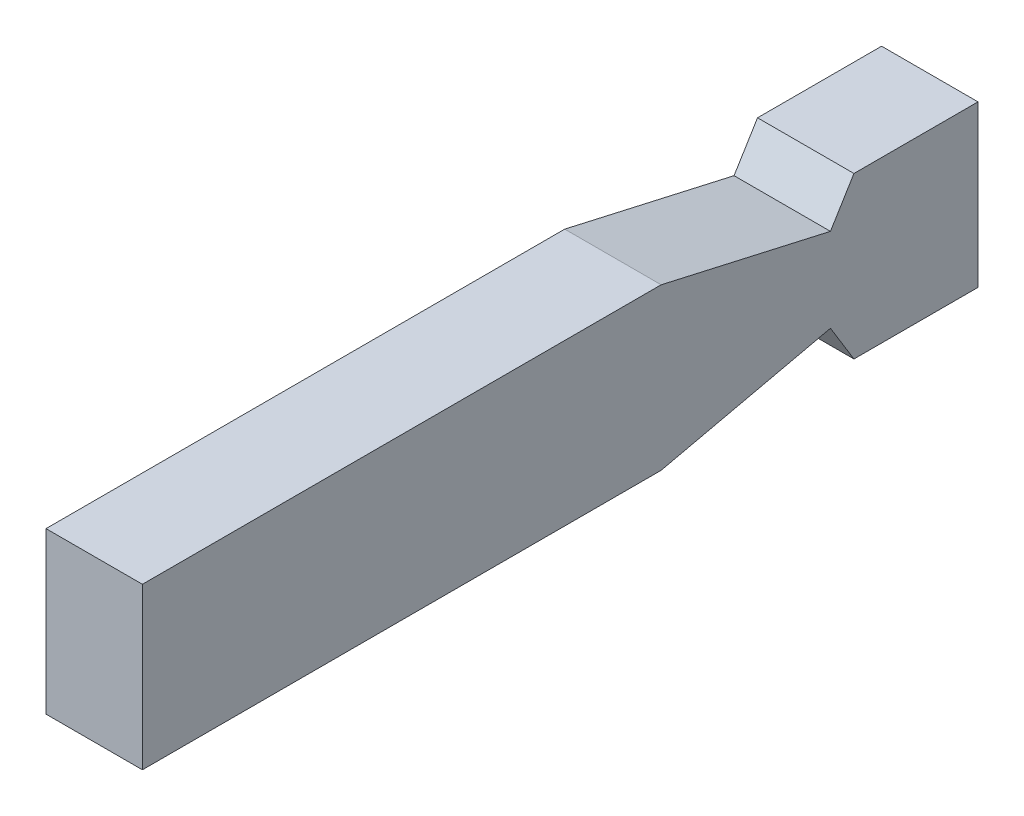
SolidWorks part; units mm, degrees
ref_plane "Face" through (0, 0, 0) normal (0, 0, 1) x (1, 0, 0)
ref_plane "Dessus" through (0, 0, 0) normal (0, 1, 0) x (1, 0, 0)
ref_plane "Droite" through (0, 0, 0) normal (1, 0, 0) x (0, 0, -1)
sketch "Esquisse1" plane through (0, 0, 0) normal (0, 0, 1) x (1, 0, 0)
  line L1 (0, 0) -> (15, 0)
  line L2 (0, 0) -> (0, 25)
  line L3 (0, 25) -> (15, 25)
  line L4 (15, 0) -> (15, 25)
  dimension "D1" = 15
  dimension "D2" = 25
extrude "Extrusion1" add sketch "Esquisse1" along normal blind 130
sketch "Esquisse4" plane through (0, 0, 0) normal (-1, 0, 0) x (0, 0, 1)
  line L0 (130, 0) -> (0, 0) construction
  line L1 (-3.4362, 12.5) -> (51.4757, 12.5) construction
  line L3 (49.3, 25) -> (19.3, 25)
  line L4 (19.3, 0) -> (22.9543, 5.9705)
  line L5 (22.9543, 5.9705) -> (49.3, 0)
  line L6 (49.3, 0) -> (19.3, 0)
  line L7 (22.9543, 19.0295) -> (49.3, 25)
  line L8 (19.3, 25) -> (22.9543, 19.0295)
  dimension "D1" = 19.3
  dimension "D2" = 30
  dimension "D3" = 7
  dimension "D4" = 12.5
  dimension "D5" = 121.469
extrude "Enlèv. mat.-Extru.1" cut sketch "Esquisse4" against normal through all
